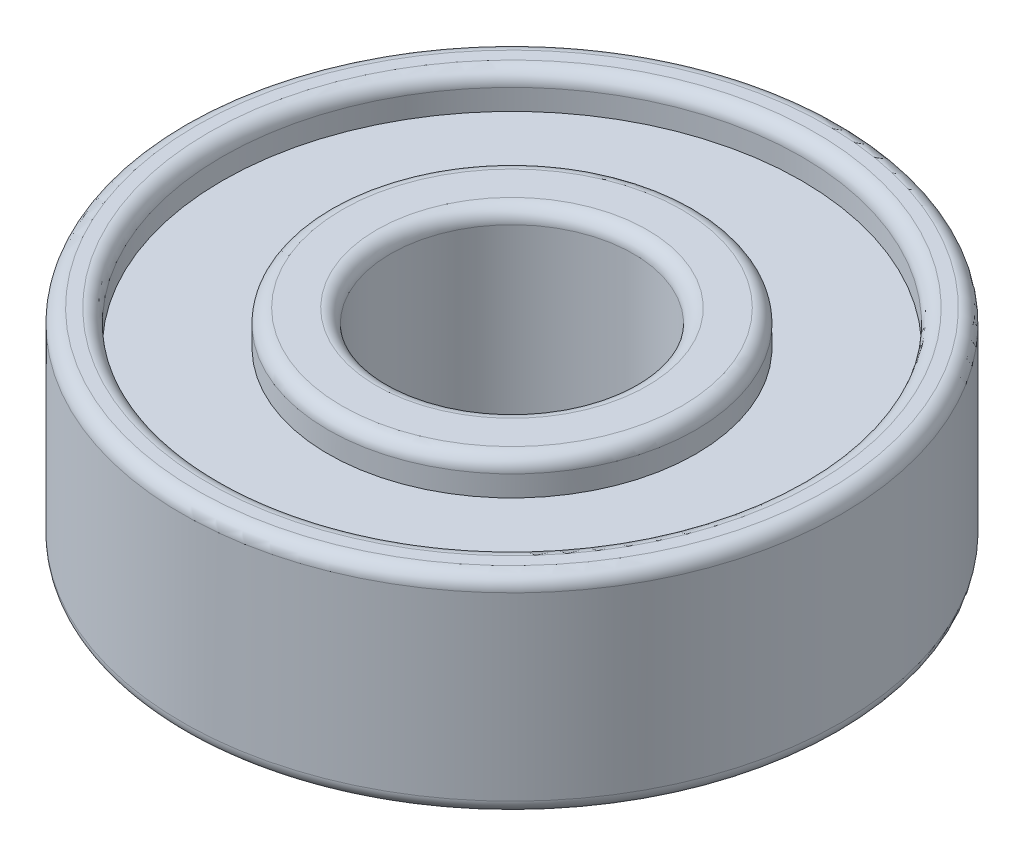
SolidWorks part; units mm, degrees
ref_plane "Face" through (0, 0, 0) normal (0, 0, 1) x (1, 0, 0)
ref_plane "Dessus" through (0, 0, 0) normal (0, 1, 0) x (1, 0, 0)
ref_plane "Droite" through (0, 0, 0) normal (1, 0, 0) x (0, 0, -1)
sketch "Esquisse1" plane through (0, 0, 0) normal (0, 0, 1) x (1, 0, 0)
  line L0 (0, 0) -> (0, 33.029) construction
  line L1 (8.35, 0) -> (9.5, 0)
  line L2 (9.5, 0) -> (9.5, 6)
  line L3 (9.5, 6) -> (8.35, 6)
  line L4 (8.35, 6) -> (8.35, 5)
  line L5 (8.35, 5) -> (5.3, 5)
  line L6 (5.3, 5) -> (5.3, 6)
  line L7 (5.3, 6) -> (3.5, 6)
  line L8 (3.5, 6) -> (3.5, 0)
  line L9 (3.5, 0) -> (5.3, 0)
  line L10 (5.3, 0) -> (5.3, 1)
  line L11 (5.3, 1) -> (8.35, 1)
  line L12 (8.35, 1) -> (8.35, 0)
  dimension "D1" = 7
  dimension "D2" = 10.6
  dimension "D3" = 16.7
  dimension "D4" = 19
  dimension "D5" = 6
  dimension "D6" = 1
revolve "Révolution1" add sketch "Esquisse1" angle 360 about L0
fillet "Congé1" radius 0.4 8 edges at (5.3, 6, 0) (3.5, 6, 0) (9.5, 6, 0) (8.35, 6, 0) (3.5, 0, 0) (5.3, 0, 0) (8.35, 0, 0) (9.5, 0, 0)
